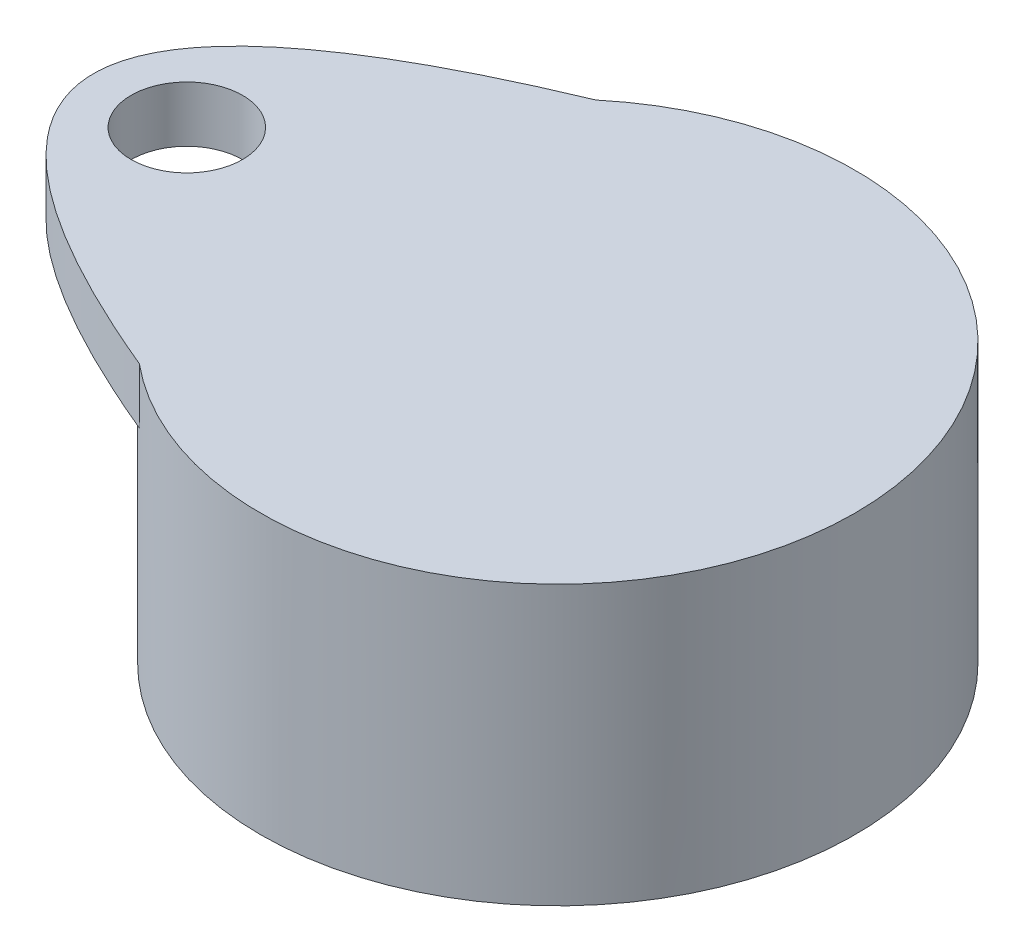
SolidWorks part; units mm, degrees
ref_plane "Front Plane" through (0, 0, 0) normal (0, 0, 1) x (1, 0, 0)
ref_plane "Top Plane" through (0, 0, 0) normal (0, 1, 0) x (1, 0, 0)
ref_plane "Right Plane" through (0, 0, 0) normal (1, 0, 0) x (0, 0, -1)
sketch "Sketch1" plane through (0, 0, 0) normal (0, 1, 0) x (1, 0, 0)
  circle A0 centre (0, 0) radius 16
  dimension "D1" = 32
extrude "Boss-Extrude1" add sketch "Sketch1" along normal blind 12
sketch "Sketch2" plane through (0, 0, 0) normal (0, -1, 0) x (1, 0, 0)
  circle A0 centre (0, 0) radius 11.75
  dimension "D1" = 23.5
extrude "Cut-Extrude1" cut sketch "Sketch2" against normal blind 5
sketch "Sketch4" plane through (0, 12, 0) normal (0, 1, 0) x (1, 0, 0)
  arc A1 (-10.24, -12.294) -> (-10.24, 12.294) centre (0, 0) ccw
  spline S0 degree 3 poles (-10.24, 12.294) (-20.08, 8.196) (-29.92, 0) (-20.08, -8.196) (-10.24, -12.294) knots 0.115813 0.115813 0.115813 0.115813 0.5 0.884187 0.884187 0.884187 0.884187
extrude "Boss-Extrude2" add sketch "Sketch4" along normal blind 3
sketch "Sketch5" plane through (0, 15, 0) normal (0, 1, 0) x (1, 0, 0)
  circle A0 centre (-19.9761, 0) radius 3
  dimension "D1" = 6
extrude "Cut-Extrude3" cut sketch "Sketch5" against normal blind 3
